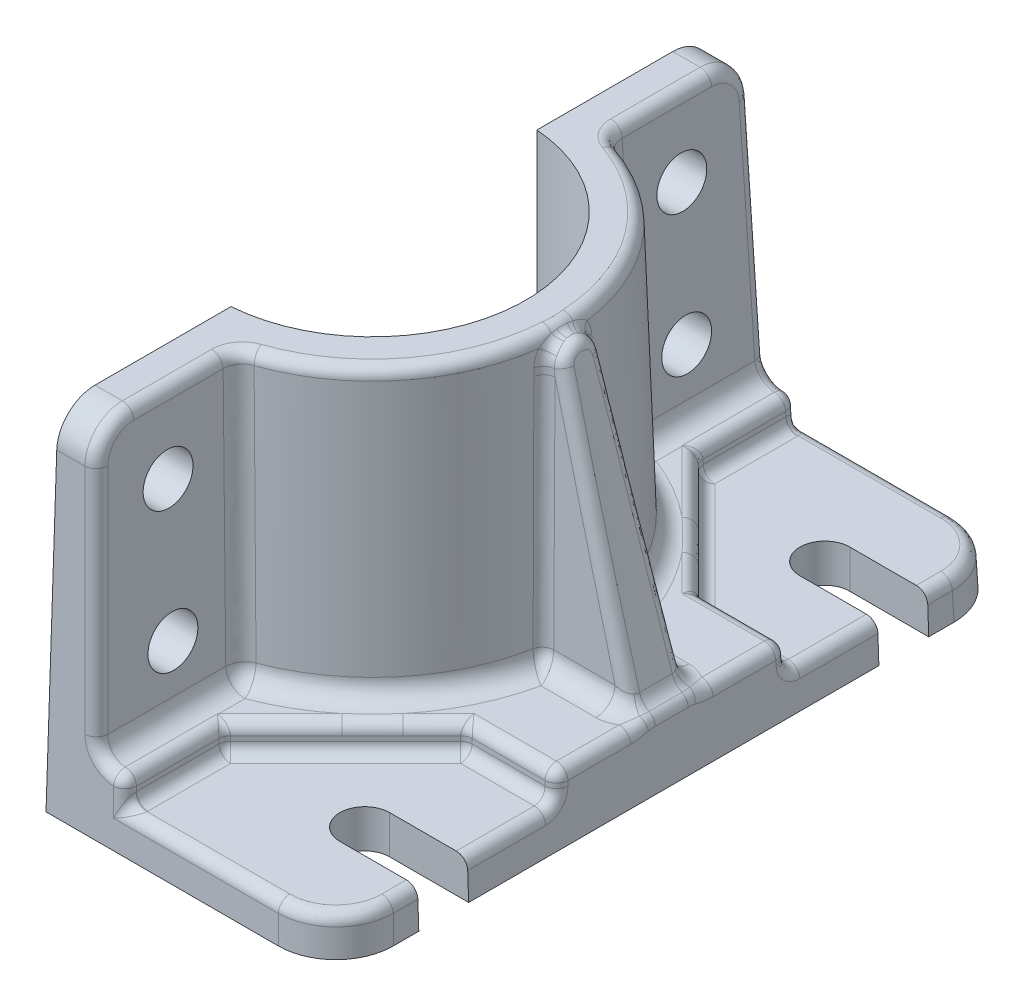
SolidWorks part; units mm, degrees
ref_plane "Face" through (0, 0, 0) normal (0, 0, 1) x (1, 0, 0)
ref_plane "Dessus" through (0, 0, 0) normal (0, 1, 0) x (1, 0, 0)
ref_plane "Droite" through (0, 0, 0) normal (1, 0, 0) x (0, 0, -1)
sketch "Esquisse1" plane through (0, 0, 0) normal (0, 1, 0) x (1, 0, 0)
  line L0 (3, 85) -> (3, 39.8873)
  line L1 (3, 85) -> (13, 85)
  line L2 (13, 85) -> (13, 48.2804)
  line L3 (40, 0) -> (50, 0)
  arc A0 (40, 0) -> (3, 39.8873) centre (0, 0) ccw
  arc A1 (50, 0) -> (13, 48.2804) centre (0, 0) ccw
  circle A2 centre (0, 0) radius 40 construction
  circle A3 centre (0, 0) radius 50 construction
  dimension "D1" = 80
  dimension "D3" = 85
  dimension "D4" = 3
  dimension "D2" = 10
extrude "Extrusion1" add sketch "Esquisse1" along normal blind 90
sketch "Esquisse2" plane through (0, 0, 0) normal (0, -1, 0) x (1, 0, 0)
  line L0 (13, -85) -> (78, -85)
  line L1 (78, -85) -> (78, 0)
  line L2 (78, 0) -> (50, 0)
  line L3 (13, -48.2804) -> (13, -85) construction
  line L4 (13, -48.2804) -> (13, -85)
  line L5 (3, -85) -> (3, -39.8873) construction
  arc A0 (13, -48.2804) -> (50, 0) centre (0, 0) ccw construction
  arc A1 (13, -48.2804) -> (50, 0) centre (0, 0) ccw
  dimension "D1" = 75
extrude "Extrusion2" add sketch "Esquisse2" against normal blind 17
mirror "Symétrie1" about plane through (40, 90, 0) normal (0, 0, -1)
ref_plane "Plan1" through (54, 0, 0) normal (1, 0, 0) x (0, 0, -1)
sketch "Esquisse4" plane through (54, 0, 0) normal (1, 0, 0) x (0, 0, -1)
  line L0 (85, 17) -> (-85, 17) construction
  line L1 (-7.3109, 17) -> (7.3109, 17)
  line L2 (-7.3109, 17) -> (-5, 83.1746)
  line L4 (7.3109, 17) -> (5, 83.1746)
  line L5 (0, 17) -> (0, 0) construction
  arc A0 (-5, 83.1746) -> (5, 83.1746) centre (0, 83) cw
  dimension "D1" = 10
  dimension "D2" = 66
  dimension "D3" = 2
extrude "Extrusion3" add sketch "Esquisse4" against normal up to surface (4.5374 mm away)
sketch "Esquisse6" plane through (0, 17, 0) normal (0, 1, 0) x (1, 0, 0)
  line L0 (23, 85) -> (23, 61.8528)
  line L1 (13, 85) -> (78, 85) construction
  line L2 (23, 61.8528) -> (54.8528, 30)
  line L3 (54.8528, 30) -> (78, 30)
  line L4 (78, 85) -> (78, -85) construction
  line L5 (78, 30) -> (78, 85)
  line L6 (78, 85) -> (23, 85)
  arc A0 (13, -48.2804) -> (13, 48.2804) centre (0, 0) ccw construction
  dimension "D3" = 60
  dimension "D1" = 45
  dimension "D2" = 55
extrude "Enlèv. mat.-Extru.1" cut sketch "Esquisse6" against normal blind 7
mirror "Symétrie2" about plane through (0, 0, 0) normal (0, 0, 1) of "Enlèv. mat.-Extru.1"
draft "Dépouille1" type of draft neutral plane draft angle 2 faces to draft 5 parameters "D1"=2
draft "Dépouille2" type of draft neutral plane draft angle 2 faces to draft 7 parameters "D1"=2
fillet "Congé11" radius 15 2 edges at (78.419, 5, -87.9683) (78.419, 5, 87.9683)
sketch "Esquisse7" plane through (0, 17, 0) normal (0, 1, 0) x (1, 0, 0)
  line L1 (54, -7.3109) -> (75, -7.3109)
  line L2 (54, -7.3109) -> (54, 7.3109)
  line L3 (54, 7.3109) -> (75, 7.3109)
  line L4 (75, 7.3109) -> (75, -7.3109)
  line L5 (3, 85) -> (3, 39.8873) construction
  dimension "D1" = 72
fillet "Congé12" radius 10 2 edges at (8, 90, -85) (8, 90, 85)
sketch "Esquisse8" plane through (54, 0, 0) normal (1, 0, 0) x (0, 0, -1)
  line L3 (-5, 83.1746) -> (-7.3109, 17)
  line L4 (-7.3109, 17) -> (7.3109, 17)
  line L5 (7.3109, 17) -> (5, 83.1746)
  line L6 (-5, 83.1746) -> (-7.3109, 17)
  line L7 (-7.3109, 17) -> (7.3109, 17)
  line L8 (7.3109, 17) -> (5, 83.1746)
  arc A1 (5, 83.1746) -> (-5, 83.1746) centre (0, 83) ccw
  arc A2 (5, 83.1746) -> (-5, 83.1746) centre (0, 83) ccw
  dimension "D1" = 0
loft "Lissage1" add profiles "Esquisse8", "Esquisse7"
fillet "Congé1" radius 3 3 edges
fillet "Congé2" radius 5 11 edges at (73.9086, 17, -6.6046) (74.3672, 17, 6.1413) (15.5492, 17, -68.8726) (40.0225, 17, -34.0532) (40.0225, 17, 34.0532) (15.5492, 17, 68.8726)
fillet "Congé7" radius 3 6 edges at (23, 17, -74.701) (38.9264, 17, -45.9264) (66.4264, 17, -30) (66.4264, 17, 30) (38.9264, 17, 45.9264) (23, 17, 74.701)
fillet "Congé8" radius 3 21 edges at (15.3807, 21.8255, 70.5089) (14.095, 90, 48.8471) (50, 90, 0) (13, 90, -63.656) (13.7701, 90, -49.3034) (23.1727, 12.0547, -87.7219) (22.2235, 16.1266, -87.5797) (16.8431, 18.4635, -87.4981) (14.3589, 51.0872, -86.3589) (13.098, 87.1934, -82.2897) (23.1727, 12.0547, 87.7219) (22.2235, 16.1266, 87.5797) (16.8431, 18.4635, 87.4981) (14.3589, 51.0872, 86.3589) (13.098, 87.1934, 82.2897) (78.2444, 10, -51.5236) (73.8548, 10, -83.404) (78.2444, 10, 51.5236) (73.8548, 10, 83.404) (43.249, 10, -87.7937) (43.249, 10, 87.7937)
fillet "Congé13" radius 3 24 edges at (22.3599, 9.158, -86.9806) (23.244, 10, -84.846) (77.4314, 9.158, -30.2738) (77.4314, 9.158, 30.2738) (22.3599, 9.158, 86.9806) (23.244, 10, 84.846) (23.2444, 10, -73.3748) (65.1507, 10, -30.2444) (39.0993, 10, -46.0993) (65.1507, 10, 30.2444) (23.2444, 10, 73.3748) (39.0993, 10, 46.0993) (22.4611, 15.8589, -61.6246) (23.101, 14.1071, -61.8947) (54.516, 16.158, -29.1869) (54.516, 16.158, 29.1869) (22.4611, 15.8589, 61.6246) (23.101, 14.1071, 61.8947) (23.1728, 12.0523, -61.9244) (54.9244, 12.0523, -30.1728) (54.9244, 12.0523, 30.1728) (23.1728, 12.0523, 61.9244)
fillet "Congé14" radius 3 18 edges at (78, 17, -5.8671) (78, 17, 0) (78, 17, 5.8671) (78, 17, 17.2574) (74.977, 17, 10.8378) (78, 17, -17.2574) (78.0294, 16.158, 29.1869) (78.0294, 16.158, -29.1869) (78.1345, 13.1479, -30.1345) (76.801, 12.7166, -30.1496) (77.4314, 9.158, -33.2003) (78.1345, 13.1479, 30.1345) (76.801, 12.7166, 30.1496) (77.4314, 9.158, 33.2003) (78.2199, 10.7022, -30.4878) (78.2199, 10.7022, 30.4878) (75.3474, 10.842, -31.0575) (75.3474, 10.842, 31.0575)
fillet "Congé15" radius 3 7 edges at (52.5949, 19.2634, -7.9547) (49.964, 84.8136, -4.6628) (50.064, 87.9133, -0.9436) (49.9915, 86.4091, 3.6617) (52.5949, 19.2634, 7.9547)
sketch "Esquisse10" plane through (0, 10, 0) normal (0, 1, 0) x (1, 0, 0)
  line L0 (58, 66.5) -> (78.5937, 66.5)
  line L2 (58, 53.5) -> (78.5937, 53.5)
  line L3 (78.5937, 66.5) -> (78.5937, 53.5)
  line L4 (3, 75.3431) -> (3, 39.8873) construction
  line L7 (78.5937, 73.152) -> (78.5937, -73.152) construction
  arc A0 (58, 66.5) -> (58, 53.5) centre (58, 60) ccw
  dimension "D1" = 6.5
  dimension "D3" = 60
  dimension "D2" = 55
extrude "Enlèv. mat.-Extru.3" cut sketch "Esquisse10" against normal through all
sketch "Esquisse12" plane through (3, 0, 0) normal (-1, 0, 0) x (0, 0, 1)
  line L0 (-88.1429, 0) -> (-39.8873, 0) construction
  circle A0 centre (-67, 70) radius 6.5
  circle A1 centre (-67, 34) radius 6.5
  dimension "D1" = 13
  dimension "D3" = 70
  dimension "D4" = 36
  dimension "D2" = 67
extrude "Enlèv. mat.-Extru.4" cut sketch "Esquisse12" against normal through all
mirror "Symétrie4" about plane through (0, 0, 0) normal (0, 0, 1) of "Enlèv. mat.-Extru.4", "Enlèv. mat.-Extru.3"
